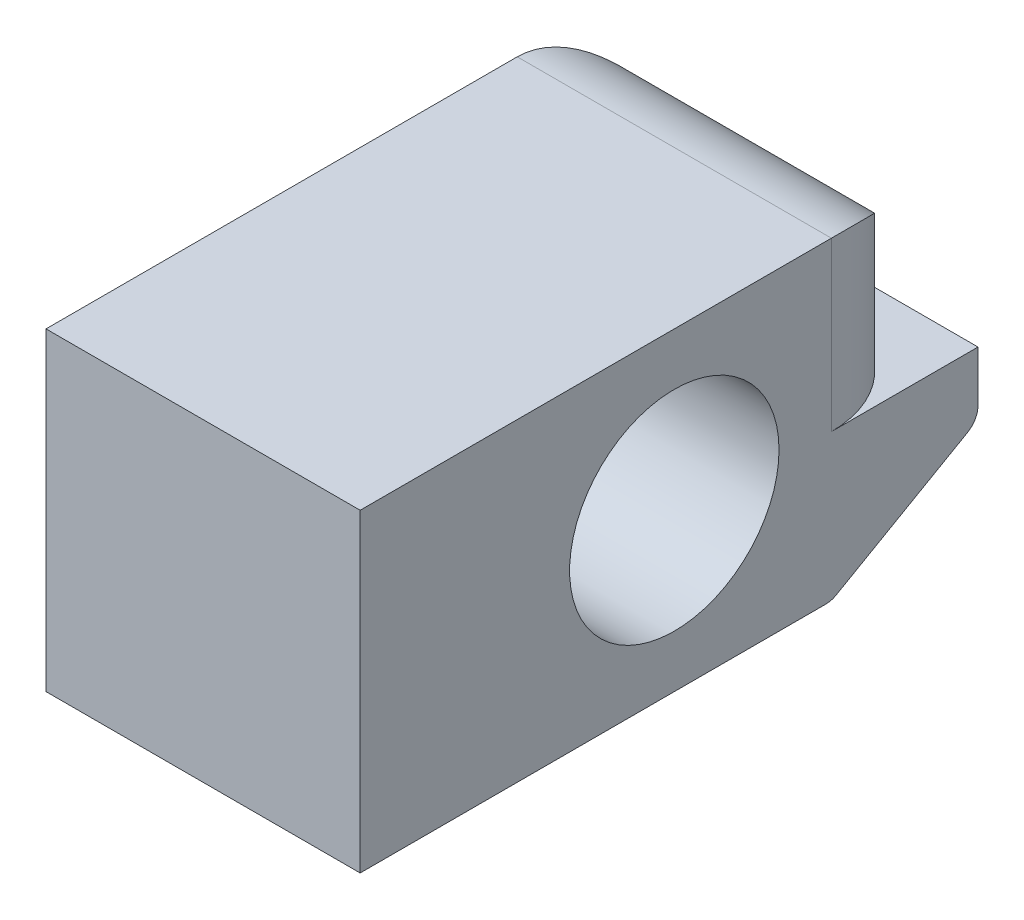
SolidWorks part; units mm, degrees
ref_plane "Front Plane" through (0, 0, 0) normal (0, 0, 1) x (1, 0, 0)
ref_plane "Top Plane" through (0, 0, 0) normal (0, 1, 0) x (1, 0, 0)
ref_plane "Right Plane" through (0, 0, 0) normal (1, 0, 0) x (0, 0, -1)
sketch "Sketch1" plane through (0, 0, 0) normal (0, 1, 0) x (1, 0, 0)
  line L0 (0, 0) -> (0, 5.5)
  line L1 (0, 5.5) -> (3, 5.5)
  line L2 (3, 5.5) -> (3, 0)
  line L3 (3, 0) -> (0, 0)
  dimension "D1" = 5.5
  dimension "D2" = 3
extrude "Boss-Extrude1" add sketch "Sketch1" along normal blind 3
fillet "Fillet1" radius 1 4 edges at (3, 1.5, -5.5) (1.5, 3, -5.5) (0, 1.5, -5.5) (1.5, 0, -5.5)
sketch "Sketch2" plane through (0, 0, 0) normal (1, 0, 0) x (0, 0, -1)
  line L0 (3, 1.5) -> (3, 3) construction
  line L1 (0, 3) -> (4.5, 3) construction
  line L2 (3, 1.5) -> (3, 0) construction
  line L3 (0, 0) -> (4.5, 0) construction
  circle A0 centre (3, 1.5) radius 1
  point P12 (3, 1.5)
  dimension "D1" = 2
  dimension "D2" = 2.5
extrude "Cut-Extrude2" cut sketch "Sketch2" against normal through all and the other way through all contours A0
ref_plane "Plane5" through (0, 0, -5.9) normal (0, 0, -1) x (-1, 0, 0)
sketch "Sketch7" plane through (0, 0, -5.9) normal (0, 0, -1) x (-1, 0, 0)
  line L0 (-3, 0.8) -> (0, 0.8)
  line L1 (-3, 0) -> (-3, 3) construction
  line L2 (0, 3) -> (0, 0) construction
  line L3 (0, 0.8) -> (0, 1.4)
  line L4 (0, 1.4) -> (-3, 1.4)
  line L5 (-3, 1.4) -> (-3, 0.8)
  line L6 (-1.5, 2) -> (-1.5, 1) construction
  line L7 (-1, 2) -> (-2, 2) construction
  line L8 (-2, 1) -> (-1, 1) construction
  point P14 (-1.5, 1.5)
  dimension "D1" = 0.1
  dimension "D2" = 0.6
extrude "Boss-Extrude5" add sketch "Sketch7" against normal up to next
ref_plane "Plane6" through (3, 0, 0) normal (1, 0, 0) x (0, 0, -1)
sketch "Sketch8" plane through (3, 0, 0) normal (1, 0, 0) x (0, 0, -1)
  line L0 (4.5, 0) -> (4.5, 0.8)
  line L1 (4.5, 0.8) -> (5.4798, 0.8)
  line L2 (5.4798, 0.8) -> (5.4798, 0)
  line L3 (5.4798, 0) -> (4.5, 0)
extrude "Cut-Extrude3" cut sketch "Sketch8" against normal blind 10
sketch "Sketch9" plane through (3, 0, 0) normal (1, 0, 0) x (0, 0, -1)
  line L0 (4.5, 0.8) -> (4.5, 0)
  line L2 (5.9, -1.2256) -> (5.9, 1.2256) construction
  line L4 (5.9, 0.8) -> (4.5, 0.8)
  line L5 (5.9, 0.8) -> (4.5, 0)
extrude "Boss-Extrude6" add sketch "Sketch9" against normal up to surface (3 mm away)
fillet "Fillet2" radius 0.2 2 edges at (1.5, 0.8, -5.9) (1.5, 0, -4.5)
